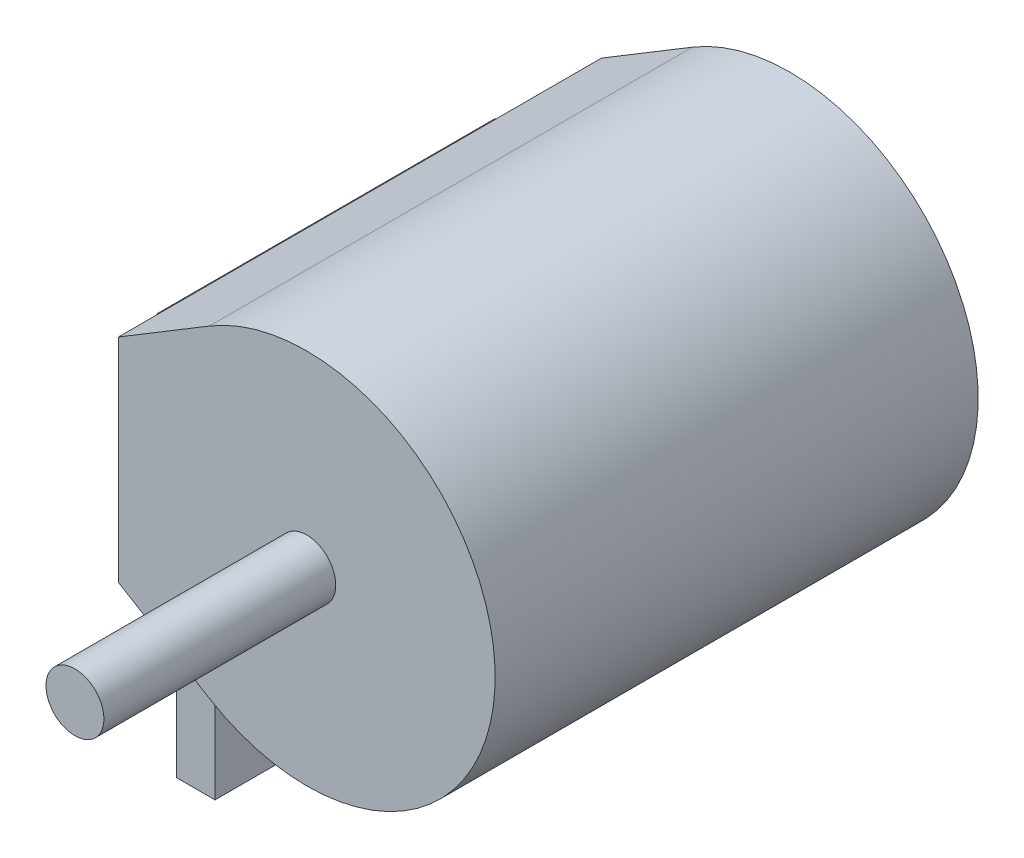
SolidWorks part; units mm, degrees
ref_plane "X" through (0, 0, 0) normal (0, 0, 1) x (1, 0, 0)
ref_plane "Y" through (0, 0, 0) normal (0, 1, 0) x (1, 0, 0)
ref_plane "Z" through (0, 0, 0) normal (1, 0, 0) x (0, 0, -1)
sketch "Esquisse1" plane through (0, 0, 0) normal (0, 0, 1) x (1, 0, 0)
  line L0 (-9.75, 5.5) -> (-9.75, -5.5)
  line L1 (-9.75, 5.5) -> (-5.0428, 8.3446)
  line L2 (0, 0) -> (-14.1399, 0) construction
  line L3 (-9.75, -5.5) -> (-5.0428, -8.3446)
  arc A0 (-5.0428, -8.3446) -> (-5.0428, 8.3446) centre (0, 0) ccw
  point P9 (-9.75, 0)
  dimension "D1" = 19.5
  dimension "D2" = 11
extrude "Base-Extrusion" add sketch "Esquisse1" along normal mid plane 25
sketch "Esquisse2" plane through (-9.75, 0, 0) normal (-1, 0, 0) x (0, 0, 1)
  line L0 (9.5, 4.5423) -> (-8, 4.5423)
  line L1 (9.5, 4.5423) -> (9.5, -4.5423)
  line L2 (-8, -4.5423) -> (9.5, -4.5423)
  line L3 (-8, -4.5423) -> (-8, 4.5423)
  line L4 (0, 0) -> (6.9721, 0) construction
  line L5 (12.5, 0) -> (-12.5, 0) construction
  line L6 (12.5, 5.5) -> (12.5, -5.5) construction
  dimension "D1" = 17.5
  dimension "D2" = 9.0846
  dimension "D3" = 3
extrude "Bos.-Extru.-Mince1" add sketch "Esquisse2" along normal blind 1 thin
sketch "Esquisse3" plane through (-9.75, 0, 0) normal (-1, 0, 0) x (0, 0, 1)
  line L0 (9.5, -5.5) -> (-9.5, -5.5)
  line L1 (9.5, -5.5) -> (9.5, -15.75)
  line L2 (-9.5, -15.75) -> (9.5, -15.75)
  line L3 (-9.5, -15.75) -> (-9.5, -5.5)
  line L4 (12.5, -5.5) -> (-12.5, -5.5) construction
  line L5 (9.5, 4.5423) -> (9.5, -4.5423) construction
  line L6 (12.5, 9.75) -> (-12.5, 9.75) construction
  dimension "D1" = 25.5
  dimension "D2" = 19
extrude "Boss.-Extru.1" add sketch "Esquisse3" against normal blind 2
sketch "Esquisse4" plane through (-9.75, 0, 0) normal (-1, 0, 0) x (0, 0, 1)
  line L0 (0, 0) -> (0, -18.8761) construction
  circle A0 centre (0, -11) radius 1.75
  dimension "D1" = 11
  dimension "D2" = 3.5
extrude "Enlèv. mat.-Extru.1" cut sketch "Esquisse4" against normal up to next
sketch "Esquisse5" plane through (0, 0, 12.5) normal (0, 0, 1) x (1, 0, 0)
  circle A0 centre (0, 0) radius 1.5
  dimension "D1" = 3
extrude "Boss.-Extru.2" add sketch "Esquisse5" along normal blind 12
